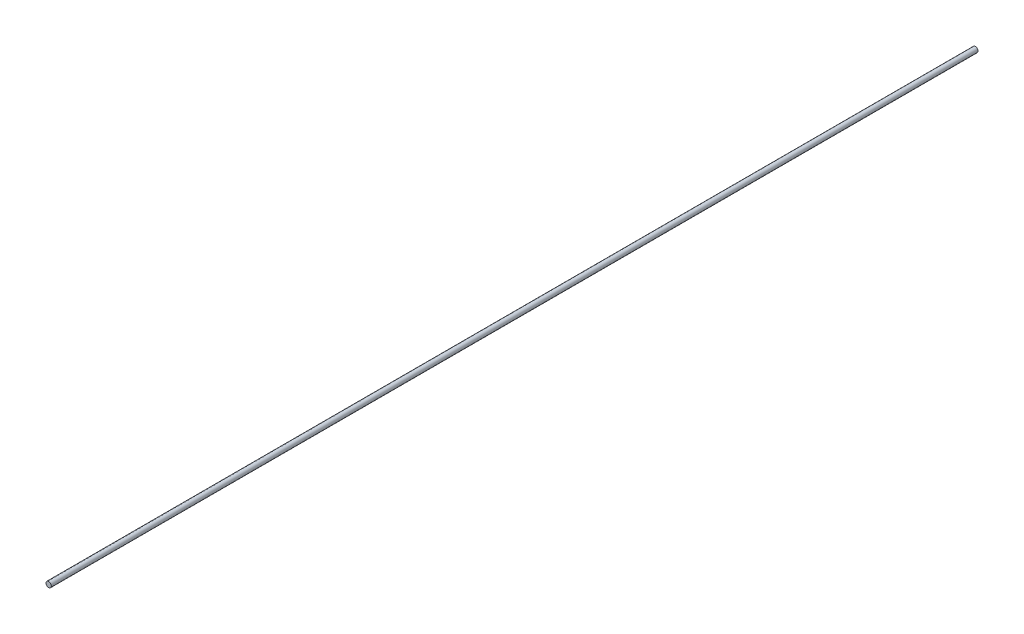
SolidWorks part; units mm, degrees
ref_plane "Plan de face" through (0, 0, 0) normal (0, 0, 1) x (1, 0, 0)
ref_plane "Plan de dessus" through (0, 0, 0) normal (0, 1, 0) x (1, 0, 0)
ref_plane "Plan de droite" through (0, 0, 0) normal (1, 0, 0) x (0, 0, -1)
sketch "Esquisse1" plane through (0, 0, 0) normal (0, 0, 1) x (1, 0, 0)
  circle A0 centre (0, 0) radius 2
  dimension "D1" = 4
extrude "Extrusion1" add sketch "Esquisse1" along normal blind 700
